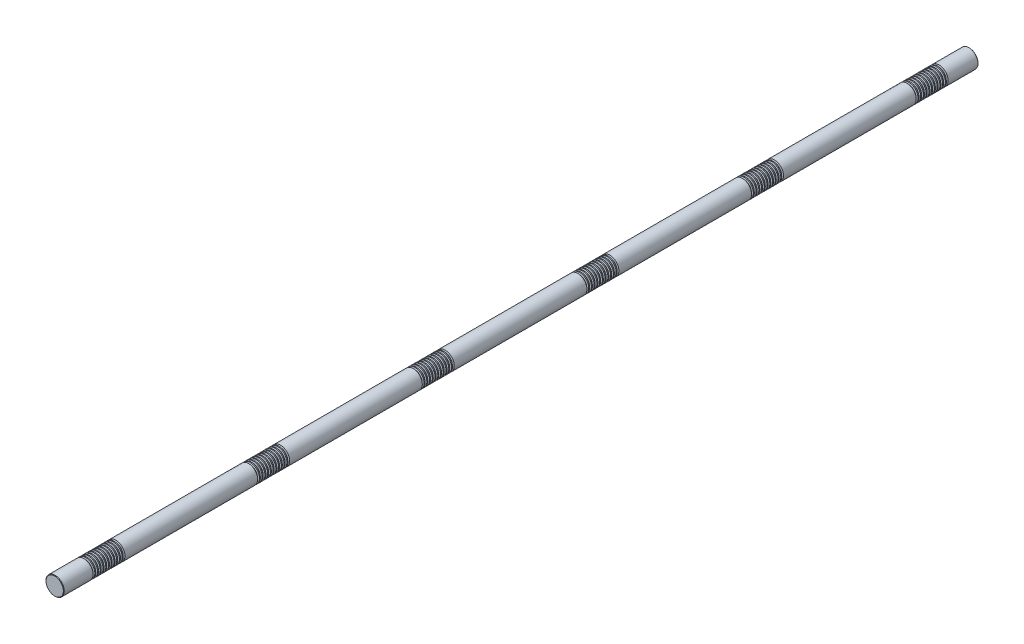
SolidWorks part; units mm, degrees
ref_plane "Front Plane" through (0, 0, 0) normal (0, 0, 1) x (1, 0, 0)
ref_plane "Top Plane" through (0, 0, 0) normal (0, 1, 0) x (1, 0, 0)
ref_plane "Right Plane" through (0, 0, 0) normal (1, 0, 0) x (0, 0, -1)
sketch "Sketch1" plane through (0, 0, 0) normal (0, 0, 1) x (1, 0, 0)
  circle A0 centre (0, 0) radius 30
  dimension "D1" = 60
extrude "Boss-Extrude1" add sketch "Sketch1" along normal mid plane 3000
chamfer "Chamfer1" distance 1.5 angle 45 2 edges at (30, 0, -1500) (30, 0, 1500)
sketch "Sketch2" plane through (0, 0, 0) normal (1, 0, 0) x (0, 0, -1)
  line L0 (1400.6699, 30) -> (1394.8301, 30)
  line L1 (1498.5, 30) -> (-1498.5, 30) construction
  line L2 (1394.8301, 30) -> (1396.1699, 25)
  line L3 (1396.1699, 25) -> (1399.3301, 25)
  line L4 (1399.3301, 25) -> (1400.6699, 30)
  line L5 (1500, -28.5) -> (1500, 28.5) construction
  point P4 (1397.75, 30)
  point P7 (1397.75, 25)
  point P8 (1400, 27.5)
  point P9 (1395.5, 27.5)
  dimension "D1" = 4.5
  dimension "D2" = 100
  dimension "D3" = 5
  dimension "D4" = 30
revolve "Cut-Revolve1" cut sketch "Sketch2" angle 360 about axis through (0, 0, 1500) along (0, 0, -1)
pattern_linear "LPattern1" count 12 spacing 9 along (0, 0, 1) of "Cut-Revolve1"
pattern_linear "LPattern2" count 6 spacing 540 along (0, 0, 1) of "Cut-Revolve1", "LPattern1"
